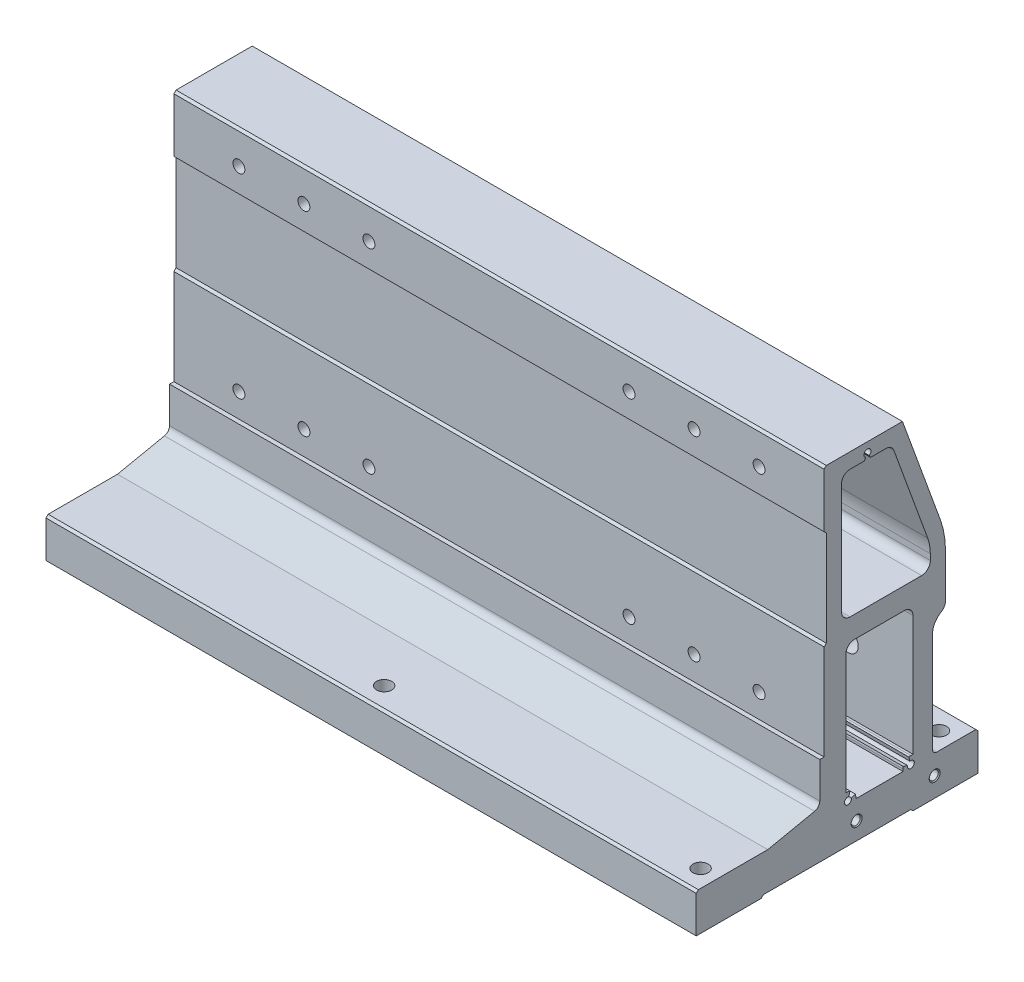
SolidWorks part; units mm, degrees
ref_plane "정면" through (0, 0, 0) normal (0, 0, 1) x (1, 0, 0)
ref_plane "윗면" through (0, 0, 0) normal (0, 1, 0) x (1, 0, 0)
ref_plane "우측면" through (0, 0, 0) normal (1, 0, 0) x (0, 0, -1)
sketch "스케치2" plane through (0, 0, 0) normal (1, 0, 0) x (0, 0, -1)
  line L0 (65, 16) -> (64, 17)
  line L1 (64, 17) -> (46, 17)
  line L2 (44, 19) -> (44, 65)
  line L3 (50, 75.3923) -> (50, 95.442)
  line L4 (47.5845, 109.1317) -> (30.149, 157)
  line L5 (30.149, 157) -> (-5, 157)
  line L6 (-5, 157) -> (-6, 156)
  line L7 (-6, 156) -> (-6, 131)
  line L8 (-6, 131) -> (-5, 130)
  line L9 (-5, 130) -> (-5, 86)
  line L10 (-5, 86) -> (-6, 85)
  line L11 (-6, 85) -> (-6, 40.9998)
  line L12 (-6, 40.9998) -> (-8, 40.9998)
  line L13 (-8, 40.9998) -> (-8, 24.4394)
  line L14 (-10.3881, 21.5025) -> (-32, 17)
  line L15 (-32, 17) -> (-64, 17)
  line L16 (-64, 17) -> (-65, 16)
  line L17 (-65, 16) -> (-65, -1)
  line L18 (-65, -1) -> (-35, -1)
  line L19 (-35, -1) -> (-34, 0)
  line L20 (-34, 0) -> (34, 0)
  line L21 (34, 0) -> (35, -1)
  line L22 (35, -1) -> (65, -1)
  line L23 (65, -1) -> (65, 16)
  line L24 (2, 146) -> (2, 95)
  line L25 (6, 91) -> (39, 91)
  line L26 (43, 95) -> (43, 97.7359)
  line L27 (41.7922, 104.5807) -> (26.2071, 147.369)
  line L28 (22.4487, 150) -> (15.4434, 150)
  line L29 (15.4434, 150) -> (14.8, 151.1144)
  line L30 (13.2, 151.1144) -> (12.5566, 150)
  line L31 (12.5566, 150) -> (6, 150)
  line L32 (4, 21.6) -> (4, 77)
  line L33 (8, 81) -> (31, 81)
  line L34 (35, 77) -> (35, 21.6)
  line L35 (35, 21.6) -> (34, 21.6)
  line L36 (33.0683, 21.4773) -> (33.5859, 19.5455)
  line L37 (32.4545, 18.4141) -> (30.5227, 18.9317)
  line L38 (30.4, 18) -> (30.4, 17)
  line L39 (30.4, 17) -> (8.6, 17)
  line L40 (8.6, 17) -> (8.6, 18)
  line L41 (8.4773, 18.9317) -> (6.5455, 18.4141)
  line L42 (5.4141, 19.5455) -> (5.9317, 21.4773)
  line L43 (5, 21.6) -> (4, 21.6)
  arc A0 (44, 19) -> (46, 17) centre (46, 19) ccw
  arc A1 (48, 71.9282) -> (44, 65) centre (52, 65) ccw
  arc A2 (48, 71.9282) -> (50, 75.3923) centre (46, 75.3923) ccw
  arc A3 (50, 95.442) -> (47.5845, 109.1317) centre (10, 95.442) ccw
  arc A4 (-10.3881, 21.5025) -> (-8, 24.4394) centre (-11, 24.4394) ccw
  arc A5 (6, 150) -> (2, 146) centre (6, 146) ccw
  arc A6 (2, 95) -> (6, 91) centre (6, 95) ccw
  arc A7 (39, 91) -> (43, 95) centre (39, 95) ccw
  arc A8 (43, 97.7359) -> (41.7922, 104.5807) centre (23, 97.7359) ccw
  arc A9 (26.2071, 147.369) -> (22.4487, 150) centre (22.4487, 146) ccw
  arc A10 (14.8, 151.1144) -> (13.2, 151.1144) centre (14, 152.5) ccw
  arc A11 (8, 81) -> (4, 77) centre (8, 77) ccw
  arc A12 (35, 77) -> (31, 81) centre (31, 77) ccw
  arc A13 (34, 21.6) -> (33.0683, 21.4773) centre (34, 18) ccw
  arc A14 (32.4545, 18.4141) -> (33.5859, 19.5455) centre (34, 18) ccw
  arc A15 (30.5227, 18.9317) -> (30.4, 18) centre (34, 18) ccw
  arc A16 (8.6, 18) -> (8.4773, 18.9317) centre (5, 18) ccw
  arc A17 (5.4141, 19.5455) -> (6.5455, 18.4141) centre (5, 18) ccw
  arc A18 (5.9317, 21.4773) -> (5, 21.6) centre (5, 18) ccw
extrude "보스-돌출1" add sketch "스케치2" along normal mid plane 300
hole_wizard "M5 나사 구멍1" positions "스케치3" profile "스케치4" tap size "M5" standard "ISO"
sketch "스케치3" plane through (150, 0, 0) normal (1, 0, 0) x (0, 0, -1)
  line L0 (65, -1) -> (65, 16) construction
  line L1 (35, -1) -> (65, -1) construction
  point P0 (45, 8)
  point P2 (9, 8)
  dimension "D1" = 20
  dimension "D2" = 36
  dimension "D3" = 9
sketch "스케치4" plane through (150, 8, -45) normal (0, 1, 0) x (0, 0, -1)
  line L0 (0, 0) -> (0, 13.2618)
  line L1 (0, 13.2618) -> (2.1, 12)
  line L2 (2.1, 12) -> (2.1, 0.425)
  line L3 (2.1, 0.425) -> (2.525, 0)
  line L5 (2.525, 0) -> (0, 0)
  line L6 (-2.1, 0.425) -> (-2.525, 0) construction
  line L10 (0, 13.2618) -> (-2.1, 12) construction
  line L11 (0, -6.35) -> (0, 107.95) construction
  dimension "탭 드릴 지름" = 4.2
  dimension "탭 드릴 깊이" = 12
  dimension "표면 카운터싱크 지름" = 5.05
  dimension "표면 카운터싱크 각도" = 90
  dimension "드릴 각도" = 118
hole_wizard "M5 소켓 머리 캡 나사용 카운터보어1" positions "스케치7" profile "스케치8" counterbore size "M5" standard "KS"
sketch "스케치7" plane through (0, 0, -50) normal (0, 0, -1) x (-1, 0, 0)
  line L0 (-150, -1) -> (150, -1) construction
  line L1 (-150, 109.1317) -> (-150, 157) construction
  point P0 (-120, 142)
  point P2 (-90, 142)
  point P4 (-60, 142)
  point P6 (-120, 52)
  point P8 (-90, 52)
  point P10 (-60, 52)
  dimension "D1" = 90
  dimension "D2" = 53
  dimension "D3" = 30
  dimension "D4" = 30
  dimension "D5" = 30
sketch "스케치8" plane through (120, 142, -50) normal (1, 0, 0) x (0, 1, 0)
  line L0 (0, 0) -> (0, 115)
  line L1 (0, 115) -> (2.75, 115)
  line L3 (2.75, 115) -> (2.75, 49)
  line L4 (2.75, 49) -> (4.75, 49)
  line L5 (4.75, 49) -> (4.75, 0)
  line L7 (4.75, 0) -> (0, 0)
  line L11 (0, -6.35) -> (0, 107.95) construction
  dimension "관통 구멍 지름" = 5.5
  dimension "관통 구멍 깊이" = 115
  dimension "카운터보어 지름" = 9.5
  dimension "카운터보어 깊이" = 49
pattern_linear "선형 패턴1" count 2 spacing 180 along (-1, 0, 0) of "M5 소켓 머리 캡 나사용 카운터보어1"
hole_wizard "Ø5.0mm 맞춤핀 구멍1" positions "스케치9" profile "스케치10" hole size "Ø5.0" standard "ISO"
sketch "스케치9" plane through (0, 0, 0) normal (0, -1, 0) x (-1, 0, 0)
  line L0 (0, 0) -> (-160.0719, 0) construction
  line L1 (-150, -34) -> (-150, 34) construction
  point P6 (-142, 0)
  point P8 (4, 0)
  dimension "D1" = 146
  dimension "D2" = 8
sketch "스케치10" plane through (-4, 0, 0) normal (1, 0, 0) x (0, 0, -1)
  line L0 (0, 0) -> (0, 11.5022)
  line L1 (0, 11.5022) -> (2.5, 10)
  line L2 (2.5, 10) -> (2.5, 0)
  line L5 (2.5, 0) -> (0, 0)
  line L10 (0, 11.5022) -> (-2.5, 10) construction
  line L11 (0, -6.35) -> (0, 107.95) construction
  dimension "구멍 지름" = 5
  dimension "구멍 깊이" = 10
  dimension "드릴 각도" = 118
hole_wizard "Ø7.0 (7) 지름 구멍1" positions "스케치11" profile "스케치12" hole size "Ø7.0" standard "ISO"
sketch "스케치11" plane through (0, -1, 0) normal (0, -1, 0) x (-1, 0, 0)
  line L0 (-150, 65) -> (150, 65) construction
  line L1 (-150, -65) -> (-150, -35) construction
  point P0 (4, -55)
  point P2 (4, 55)
  point P4 (-142, 55)
  point P6 (-142, -55)
  dimension "D1" = 10
  dimension "D2" = 110
  dimension "D3" = 8
  dimension "D4" = 146
sketch "스케치12" plane through (-4, -1, 55) normal (1, 0, 0) x (0, 0, -1)
  line L0 (0, 0) -> (0, 158)
  line L1 (0, 158) -> (3.5, 158)
  line L2 (3.5, 158) -> (3.5, 0)
  line L5 (3.5, 0) -> (0, 0)
  line L11 (0, -6.35) -> (0, 107.95) construction
  dimension "관통 구멍 지름" = 7
  dimension "관통 구멍 깊이" = 158
